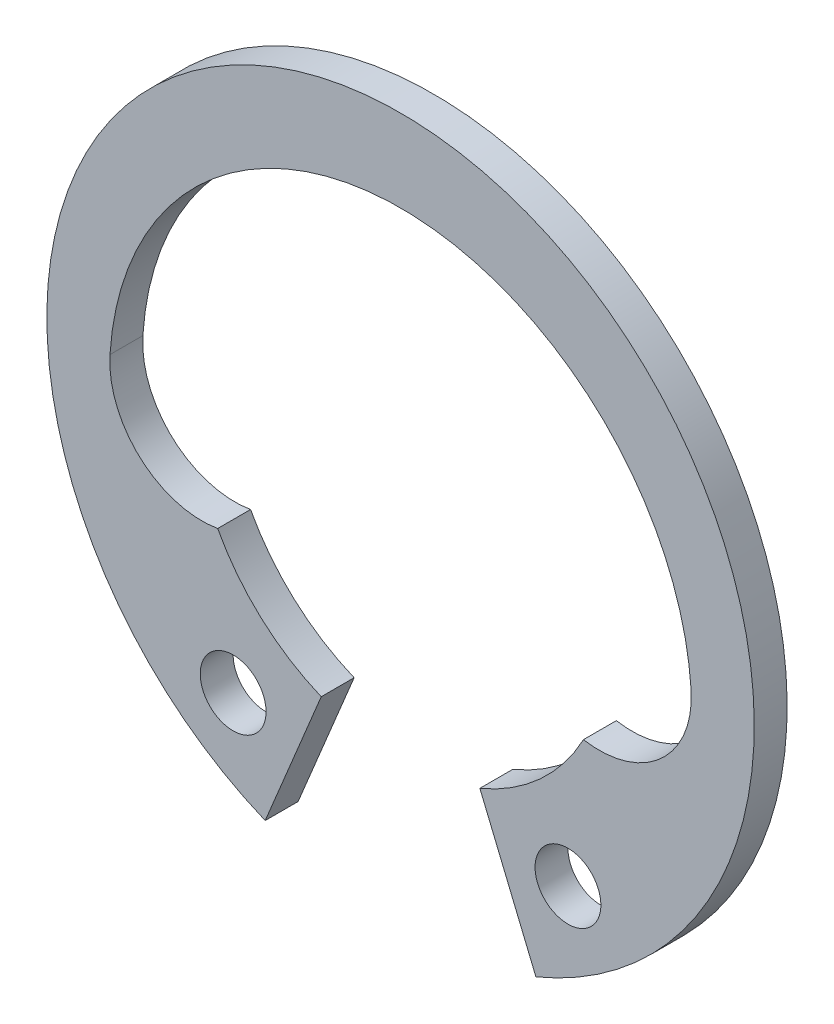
SolidWorks part; units mm, degrees
ref_plane "Front" through (0, 0, 0) normal (0, 0, 1) x (1, 0, 0)
ref_plane "Top" through (0, 0, 0) normal (0, 1, 0) x (1, 0, 0)
ref_plane "Right" through (0, 0, 0) normal (1, 0, 0) x (0, 0, -1)
other "Configuration Table"
sketch "Sketch1" plane through (0, 0, 0) normal (0, 0, 1) x (1, 0, 0)
  line L0 (-2.4109, -5.8204) -> (-4.1138, -9.9317)
  line L1 (2.4109, -5.8204) -> (4.1138, -9.9317)
  line L2 (0, 17.9027) -> (0, -23.5886) construction
  arc A0 (4.1138, -9.9317) -> (-4.1138, -9.9317) centre (0, 0) ccw
  arc A1 (8.8313, -0.0256) -> (-8.8313, -0.0256) centre (0, -0.6) ccw
  arc A2 (3.3293, -8.0378) -> (-3.3293, -8.0378) centre (0, 0) ccw construction
  circle A3 centre (5.0879, -7.0571) radius 1
  arc A4 (-8.8313, -0.0256) -> (-5.5581, -2.966) centre (-6.0372, -0.2073) ccw
  arc A5 (-5.5581, -2.966) -> (-2.4109, -5.8204) centre (0, 0) ccw
  circle A6 centre (-5.0879, -7.0571) radius 1
  arc A8 (5.5581, -2.966) -> (2.4109, -5.8204) centre (0, 0) cw
  arc A9 (8.8313, -0.0256) -> (5.5581, -2.966) centre (6.0372, -0.2073) cw
  dimension "R2" = 2.8
  dimension "d1" = 2
  dimension "d0" = 17.7
  dimension "D" = 21.5
  dimension "R" = 8.7
  dimension "a" = 4.45
  dimension "c" = 0.6
  dimension "Angle" = 45
  dimension "B" = 4
  dimension "B1" = 2
extrude "Body" add sketch "Sketch1" against normal blind 1
